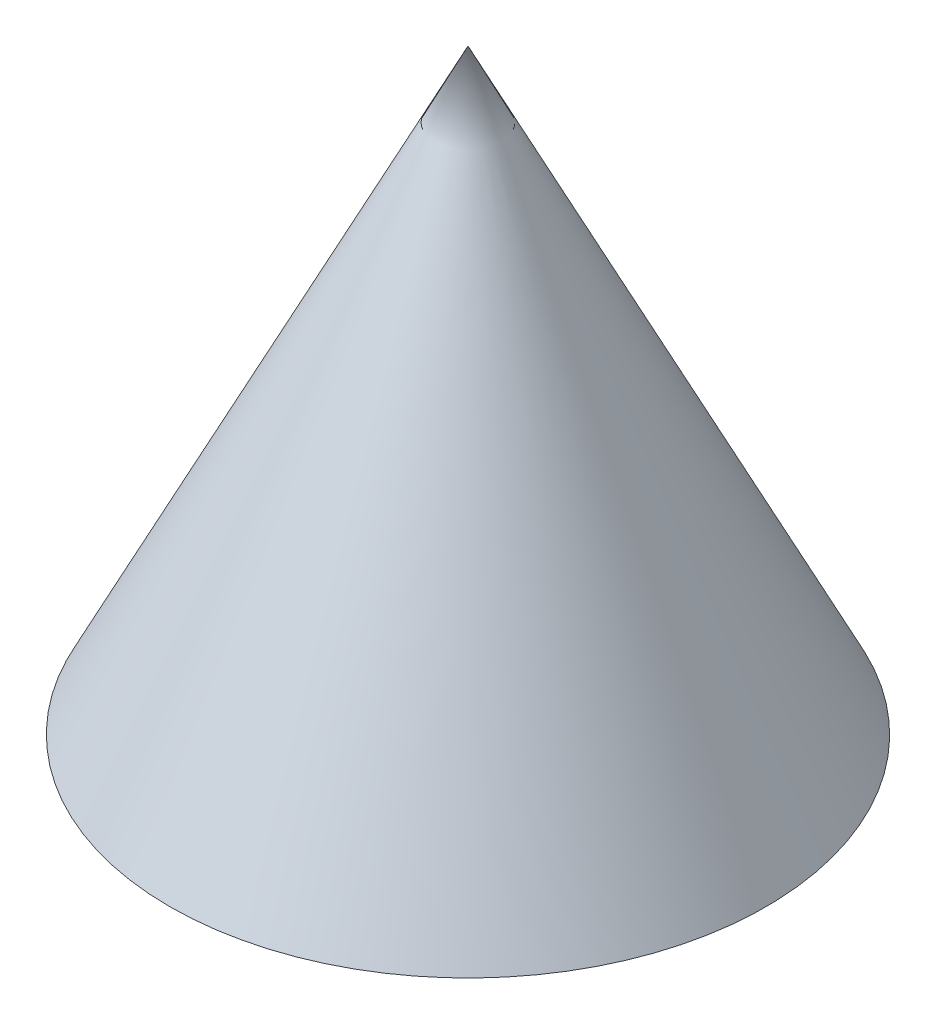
SolidWorks part; units mm, degrees
ref_plane "前视基准面" through (0, 0, 0) normal (0, 0, 1) x (1, 0, 0)
ref_plane "上视基准面" through (0, 0, 0) normal (0, 1, 0) x (1, 0, 0)
ref_plane "右视基准面" through (0, 0, 0) normal (1, 0, 0) x (0, 0, -1)
other "Configuration Table"
sketch "草图1" plane through (0, 0, 0) normal (0, 1, 0) x (1, 0, 0)
  circle A0 centre (0, 0) radius 40
  point P3 (0, 0)
sketch "草图3" plane through (0, 0, 0) normal (0, 0, 1) x (1, 0, 0)
  line L0 (0, 0) -> (0, 80) construction
  point P5 (0, 80)
loft "放样1" add profiles "草图3", "草图1"
